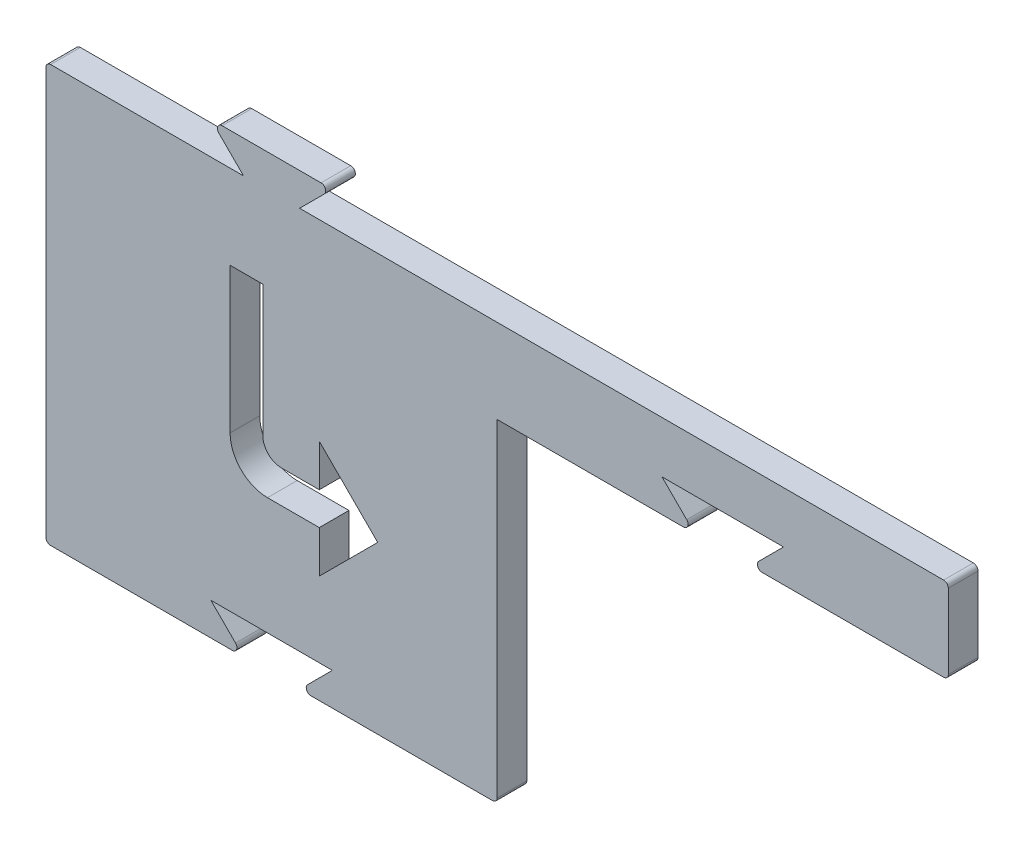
SolidWorks part; units mm, degrees
ref_plane "Front" through (0, 0, 0) normal (0, 0, 1) x (1, 0, 0)
ref_plane "Top" through (0, 0, 0) normal (0, 1, 0) x (1, 0, 0)
ref_plane "Right" through (0, 0, 0) normal (1, 0, 0) x (0, 0, -1)
sketch "Sketch1" plane through (0, 0, 0) normal (0, 0, 1) x (1, 0, 0)
  line L0 (0, 0) -> (0, 35.56) construction
  line L1 (48.26, 35.56) -> (48.26, 0)
  line L2 (48.26, 0) -> (0, 0) construction
  line L3 (0, 35.56) -> (48.26, 35.56) construction
  line L4 (0, 17.78) -> (48.26, 17.78) construction
  line L5 (24.13, 35.56) -> (24.13, 0) construction
  line L6 (0, 35.56) -> (0, 44.56)
  line L7 (0, 44.56) -> (21.13, 44.56)
  line L8 (21.13, 44.56) -> (17.63, 48.06)
  line L9 (65.89, 39.06) -> (69.39, 35.56)
  line L10 (17.63, 48.06) -> (30.63, 48.06)
  line L11 (0, 0) -> (21.13, 0)
  line L12 (21.13, 0) -> (17.63, 3.5)
  line L13 (17.63, 3.5) -> (30.63, 3.5)
  line L14 (30.63, 3.5) -> (27.13, 0)
  line L15 (27.13, 0) -> (48.26, 0)
  line L16 (0, 35.56) -> (0, 0)
  line L33 (30.63, 48.06) -> (27.13, 44.56)
  line L36 (27.13, 44.56) -> (96.52, 44.56)
  line L37 (96.52, 44.56) -> (96.52, 35.56)
  line L38 (96.52, 35.56) -> (75.39, 35.56)
  line L39 (75.39, 35.56) -> (78.89, 39.06)
  line L40 (78.89, 39.06) -> (65.89, 39.06)
  line L42 (69.39, 35.56) -> (48.26, 35.56)
  point P9 (24.13, 48.06)
  point P10 (24.13, 3.5)
  point P13 (72.39, 39.06)
  dimension "D1" = 35.56
  dimension "D3" = 48.26
  dimension "D4" = 9
  dimension "D5" = 3.5
  dimension "D6" = 45
  dimension "D7" = 3.5
  dimension "D8" = 3
  dimension "D9" = 48.26
  dimension "D10" = 3
  dimension "D11" = 24.13
  dimension "D21" = 3
  dimension "D22" = 45
  dimension "D23" = 3.5
  dimension "D25" = 45
extrude "Boss-Extrude1" add sketch "Sketch1" along normal blind 3.175
sketch "Sketch4" plane through (0, 0, 3.175) normal (0, 0, 1) x (1, 0, 0)
  line L0 (23.1926, 35.56) -> (23.1926, 19.53)
  line L1 (23.1926, 19.53) -> (29.2315, 19.53)
  line L2 (29.2315, 19.53) -> (29.2315, 24.03)
  line L3 (29.2315, 24.03) -> (35.4815, 17.78)
  line L4 (35.4815, 17.78) -> (29.2315, 11.53)
  line L5 (29.2315, 11.53) -> (29.2315, 16.03)
  line L6 (29.2315, 16.03) -> (19.6926, 16.03)
  line L7 (19.6926, 16.03) -> (19.6926, 35.56)
  line L8 (19.6926, 35.56) -> (23.1926, 35.56)
  line L9 (29.2315, 19.53) -> (29.2315, 16.03) construction
  line L10 (35.4815, 17.78) -> (19.6926, 17.78) construction
  line L12 (48.26, 35.56) -> (69.39, 35.56) construction
  line L14 (27.13, 0) -> (48.26, 0) construction
  dimension "D1" = 3.5
  dimension "D2" = 4.5
  dimension "D3" = 19.53
  dimension "D4" = 17.78
extrude "Cut-Extrude2" cut sketch "Sketch4" against normal through all
fillet "Fillet1" radius 2 1 edges at (23.1926, 19.53, 1.5875)
fillet "Fillet2" radius 4 1 edges at (19.6926, 16.03, 1.5875)
fillet "Fillet3" radius 0.5 11 edges at (0, 44.56, 1.5875) (17.63, 48.06, 1.5875) (30.63, 48.06, 1.5875) (96.52, 44.56, 1.5875) (69.39, 35.56, 1.5875) (96.52, 35.56, 1.5875) (75.39, 35.56, 1.5875) (27.13, 0, 1.5875) (21.13, 0, 1.5875) (0, 0, 1.5875) (48.26, 0, 1.5875)
